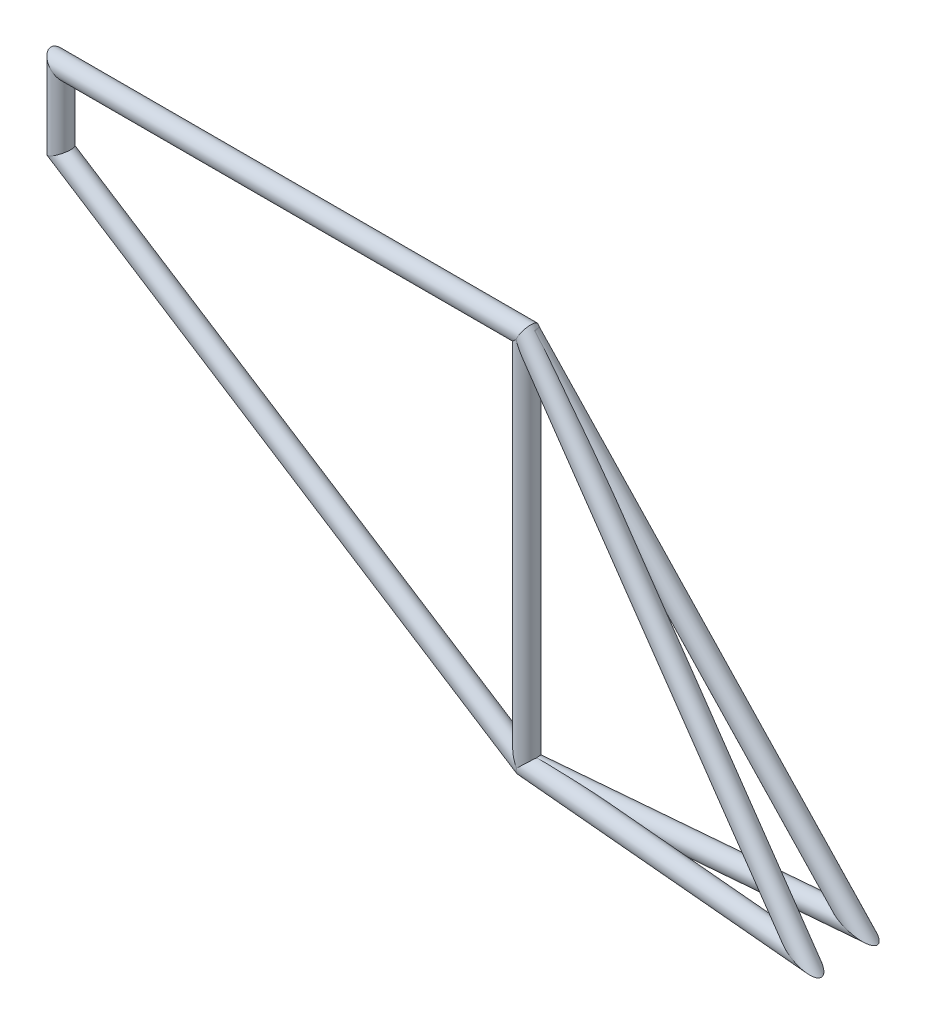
SolidWorks part; units mm, degrees
ref_plane "Front Plane" through (0, 0, 0) normal (0, 0, 1) x (1, 0, 0)
ref_plane "Top Plane" through (0, 0, 0) normal (0, 1, 0) x (1, 0, 0)
ref_plane "Right Plane" through (0, 0, 0) normal (1, 0, 0) x (0, 0, -1)
sketch3d "3DSketch1"
  line L0 (0, 0, 0) -> (0, 400, 0)
  line L1 (0, 400, 0) -> (-500, 400, 0)
  line L2 (-500, 400, 0) -> (-500, 320, 0)
  line L3 (-500, 320, 0) -> (0, 0, 0)
  line L4 (0, 0, 0) -> (323.7633, 0, 28.3256)
  line L5 (0, 0, 0) -> (323.7633, 0, -28.3256)
  line L6 (0, 0, 0) -> (322.0189, 0, 0) construction
  line L7 (323.7633, 0, 28.3256) -> (0, 400, 0)
  line L8 (323.7633, 0, -28.3256) -> (0, 400, 0)
  dimension "D1" = 400
  dimension "D3" = 500
  dimension "D2" = 80
  dimension "D4" = 10
  dimension "D6" = 325
  dimension "D5" = 5
other "Structural Member4"
ref_plane "Plane4" through (0, 400, 0) normal (-1, 0, 0) x (0, 0, 1)
sketch "Sketch1" plane through (0, 400, 0) normal (-1, 0, 0) x (0, 0, 1)
  circle A0 centre (0, 0) radius 7.8994
  circle A1 centre (0, 0) radius 10.668
  circle A2 centre (0, 0) radius 6.35 construction
  point P5 (0, 0)
